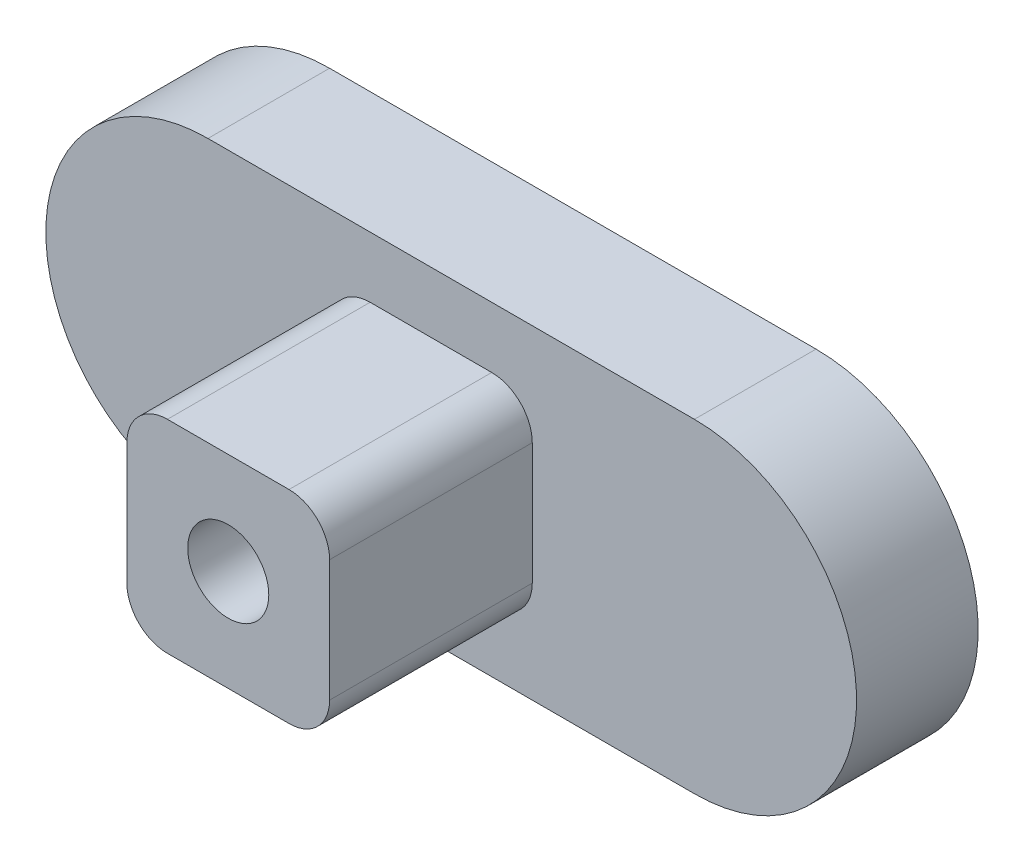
SolidWorks part; units mm, degrees
ref_plane "Face" through (0, 0, 0) normal (0, 0, 1) x (1, 0, 0)
ref_plane "Dessus" through (0, 0, 0) normal (0, 1, 0) x (1, 0, 0)
ref_plane "Droite" through (0, 0, 0) normal (1, 0, 0) x (0, 0, -1)
sketch "Esquisse1" plane through (0, 0, 0) normal (0, 0, 1) x (1, 0, 0)
  line L0 (-6, 0) -> (6, 0) construction
  line L1 (-6, 4) -> (6, 4)
  line L2 (6, -4) -> (-6, -4)
  arc A0 (-6, 4) -> (-6, -4) centre (-6, 0) ccw
  arc A1 (6, -4) -> (6, 4) centre (6, 0) ccw
  dimension "D3" = 8
  dimension "D4" = 8
  dimension "D1" = 6
  dimension "D2" = 12
extrude "Extrusion1" add sketch "Esquisse1" along normal blind 3
sketch "Esquisse2" plane through (0, 0, 3) normal (0, 0, 1) x (1, 0, 0)
  line L0 (-6, -4) -> (6, -4) construction
  line L1 (-2, 2.5) -> (1, 2.5)
  line L2 (-3, 1.5) -> (-3, -1.5)
  line L3 (-2, -2.5) -> (1, -2.5)
  line L4 (2, 1.5) -> (2, -1.5)
  arc A0 (1, 2.5) -> (2, 1.5) centre (1, 1.5) cw
  arc A1 (-2, 2.5) -> (-3, 1.5) centre (-2, 1.5) ccw
  arc A2 (-3, -1.5) -> (-2, -2.5) centre (-2, -1.5) ccw
  arc A3 (1, -2.5) -> (2, -1.5) centre (1, -1.5) ccw
  point P8 (2, 2.5)
  point P11 (-3, 2.5)
  point P14 (-3, -2.5)
  dimension "D5" = 1
  dimension "D1" = 5
  dimension "D2" = 5
  dimension "D3" = 1.5
  dimension "D4" = 4
extrude "Extrusion2" add sketch "Esquisse2" along normal blind 5
sketch "Esquisse3" plane through (0, 0, 8) normal (0, 0, 1) x (1, 0, 0)
  line L0 (2, -1.5) -> (2, 1.5) construction
  line L1 (1, 2.5) -> (-2, 2.5) construction
  circle A0 centre (-0.5, 0) radius 1
  dimension "D3" = 2
  dimension "D1" = 2.5
  dimension "D2" = 2.5
extrude "Enlèv. mat.-Extru.1" cut sketch "Esquisse3" against normal blind 7
sketch "Esquisse4" plane through (0, 0, 0) normal (0, 0, -1) x (-1, 0, 0)
  line L1 (-6, 4) -> (6, 4) construction
  line L2 (3, -2.5) -> (3, 2.5)
  line L4 (2, -2.5) -> (2, 2.5)
  arc A0 (2, -2.5) -> (3, -2.5) centre (2.5, -2.5) ccw
  arc A1 (3, 2.5) -> (2, 2.5) centre (2.5, 2.5) ccw
  dimension "D1" = 5
  dimension "D2" = 1.5
  dimension "D3" = 1
  dimension "D4" = 3.5
extrude "Extrusion3" add sketch "Esquisse4" along normal blind 1
fillet "Congé1" radius 0.5 4 edges at (-2, 0, -1) (-2.5, 3, -1) (-3, 0, -1) (-2.5, -3, -1)
pattern_linear "Répétition linéaire2" count 3 spacing 3 along (1, 0, 0) of "Extrusion3", "Congé1"
